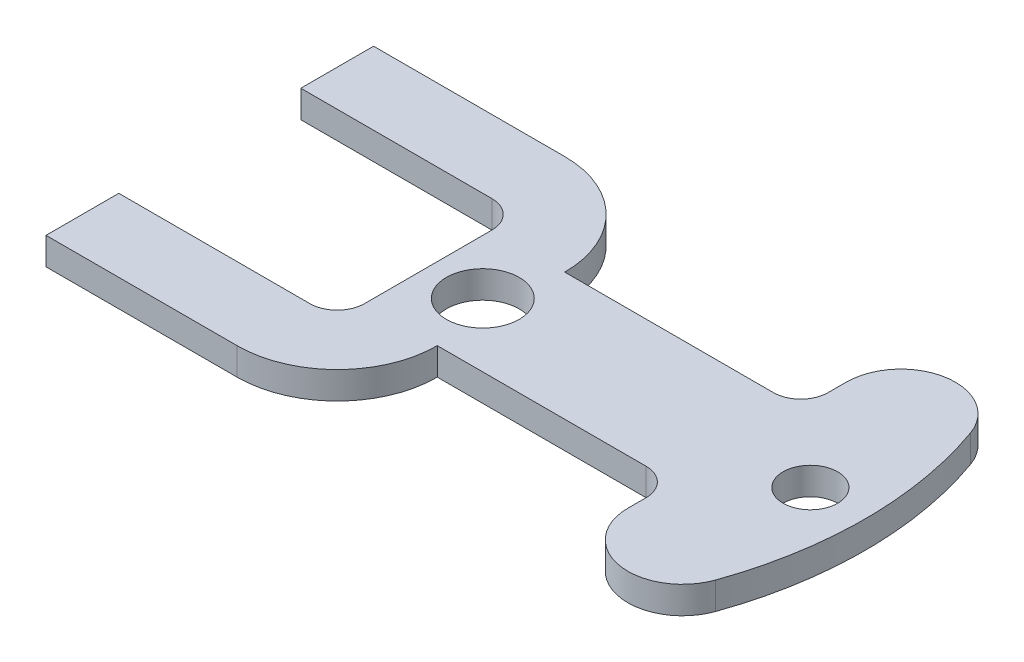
SolidWorks part; units mm, degrees
ref_plane "Front Plane" through (0, 0, 0) normal (0, 0, 1) x (1, 0, 0)
ref_plane "Top Plane" through (0, 0, 0) normal (0, 1, 0) x (1, 0, 0)
ref_plane "Right Plane" through (0, 0, 0) normal (1, 0, 0) x (0, 0, -1)
sketch "Sketch1" plane through (0, 0, 0) normal (0, 1, 0) x (1, 0, 0)
  line L0 (0, 0) -> (36, 0) construction
  line L1 (2, -7) -> (24.9411, -7)
  line L2 (2, 7) -> (24.9411, 7)
  line L3 (-30, 18) -> (-30, 10)
  line L4 (-30, -18) -> (-9, -18)
  line L5 (0, 7) -> (36, 7) construction
  line L6 (-9, 18) -> (-30, 18)
  line L7 (-30, 10) -> (-9, 10)
  line L8 (-6, 7) -> (-6, -7)
  line L9 (-9, -10) -> (-30, -10)
  line L10 (-30, -10) -> (-30, -18)
  line L11 (0, -7) -> (36, -7) construction
  line L12 (27.9411, 12) -> (27.9411, 10)
  line L13 (27.9411, -10) -> (27.9411, -12)
  line L14 (35.3129, 7) -> (36, 7)
  line L15 (35.3129, -7) -> (36, -7)
  circle A0 centre (0, 0) radius 4
  circle A1 centre (36, 0) radius 3
  arc A2 (-6, 7) -> (-9, 10) centre (-9, 7) ccw
  arc A3 (-9, -10) -> (-6, -7) centre (-9, -7) ccw
  circle A4 centre (0, 0) radius 36 construction
  arc A5 (-9, -18) -> (2, -7) centre (-9, -7) ccw
  arc A6 (2, 7) -> (-9, 18) centre (-9, 7) ccw
  arc A7 (39.598, 14) -> (27.9411, 12) centre (33.9411, 12) ccw
  arc A8 (27.9411, -12) -> (39.598, -14) centre (33.9411, -12) ccw
  arc A9 (39.598, -14) -> (39.598, 14) centre (0, 0) ccw
  arc A10 (24.9411, 7) -> (27.9411, 10) centre (24.9411, 10) ccw
  arc A11 (27.9411, -10) -> (24.9411, -7) centre (24.9411, -10) ccw
  point P21 (-6, -10)
  dimension "D1" = 8
  dimension "D2" = 6
  dimension "D12" = 3
  dimension "D13" = 11
  dimension "D16" = 12
  dimension "D17" = 12
  dimension "D18" = 6
  dimension "D19" = 6
  dimension "D21" = 9
  dimension "D3" = 36
  dimension "D6" = 10
  dimension "D7" = 8
  dimension "D8" = 10
  dimension "D9" = 8
  dimension "D10" = 30
  dimension "D11" = 24
  dimension "D14" = 12
  dimension "D15" = 12
  dimension "D4" = 7
  dimension "D5" = 7
extrude "Extrude1" add sketch "Sketch1" along normal blind 3
